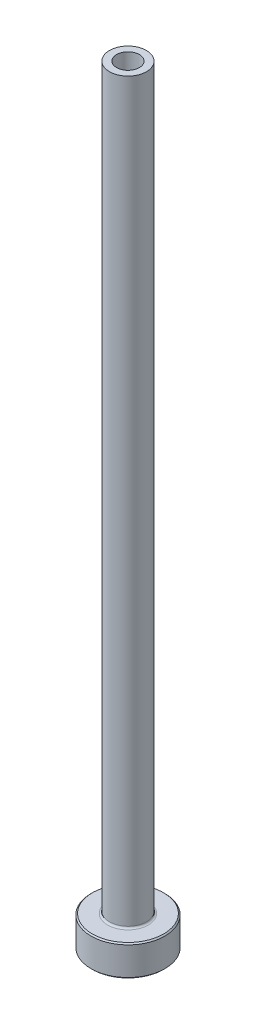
SolidWorks part; units mm, degrees
ref_plane "Front Plane" through (0, 0, 0) normal (0, 0, 1) x (1, 0, 0)
ref_plane "Top Plane" through (0, 0, 0) normal (0, 1, 0) x (1, 0, 0)
ref_plane "Right Plane" through (0, 0, 0) normal (1, 0, 0) x (0, 0, -1)
sketch "Sketch1" plane through (0, 0, 0) normal (0, 0, 1) x (1, 0, 0)
  line L0 (-1.85, 125) -> (-3, 125)
  line L1 (-3, 125) -> (-3, 5)
  line L2 (-3, 5) -> (-6, 5)
  line L3 (-6, 5) -> (-6, 0)
  line L4 (6.6, 0) -> (-6.6, 0) construction
  line L5 (-6, 0) -> (-2.1, 0)
  line L6 (-1.85, 80) -> (-1.85, 125)
  line L7 (0, 92.1877) -> (0, -15.5353) construction
  line L8 (0, -6.6) -> (0, 6.6) construction
  line L9 (-1.85, 80) -> (-2.1, 68)
  line L10 (-2.1, 68) -> (-2.1, 0)
  dimension "D1" = 0.25
  dimension "ID" = 3.7
  dimension "OD" = 6
  dimension "L" = 125
  dimension "H" = 12
  dimension "T" = 5
  dimension "N" = 45
  dimension "D2" = 12
revolve "Revolve1" add sketch "Sketch1" angle 360 about L7
fillet "Fillet1" radius 0.3 1 edges at (0, 5, 3)
chamfer "Chamfer1" distance 0.2 angle 45 2 edges at (0, 5, 6) (0, 0, 6)
chamfer "Chamfer3" distance 0.5 angle 45 1 edges at (0, 0, 2.1)
